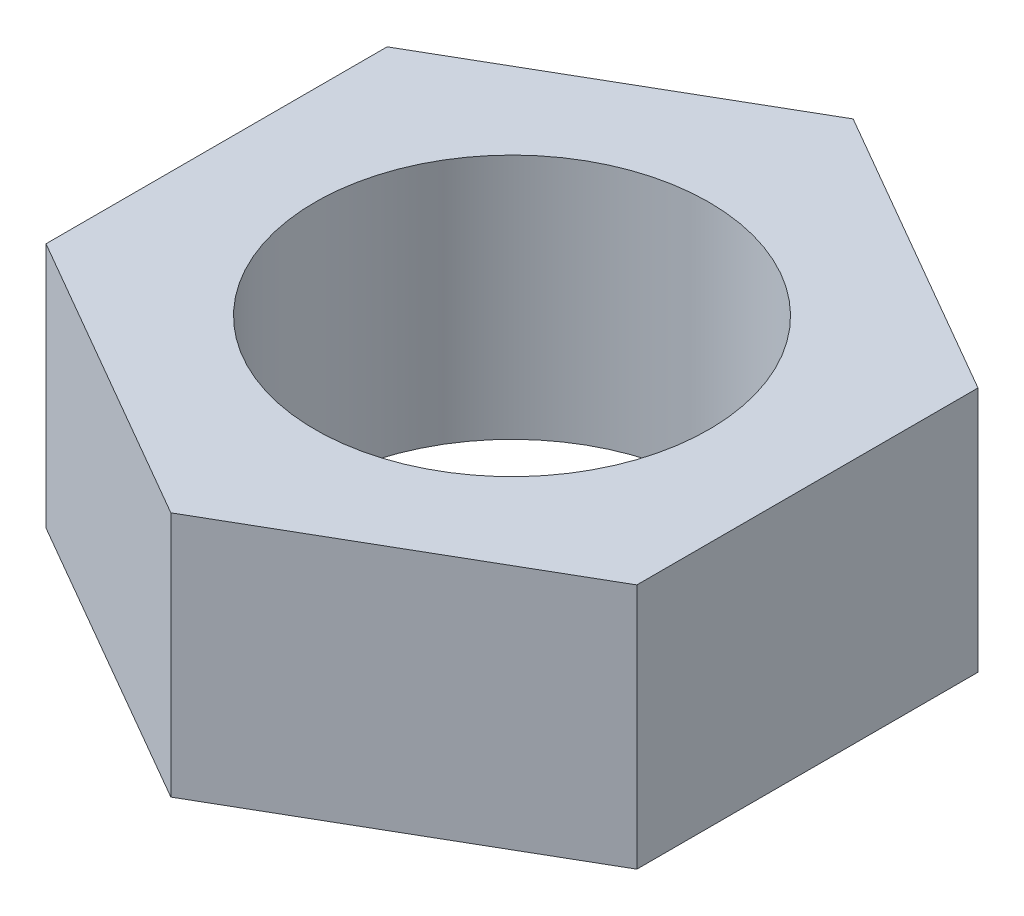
SolidWorks part; units mm, degrees
ref_plane "Front" through (0, 0, 0) normal (0, 0, 1) x (1, 0, 0)
ref_plane "Top" through (0, 0, 0) normal (0, 1, 0) x (1, 0, 0)
ref_plane "Right" through (0, 0, 0) normal (1, 0, 0) x (0, 0, -1)
sketch "Sketch3" plane through (0, 0, 0) normal (0, 1, 0) x (1, 0, 0)
  line L0 (0, -50) -> (0, 50) construction
  line L1 (0, 10.9985) -> (-9.525, 5.4993)
  line L2 (-9.525, 5.4993) -> (-9.525, -5.4993)
  line L3 (-9.525, -5.4993) -> (0, -10.9985)
  line L4 (0, -10.9985) -> (9.525, -5.4993)
  line L5 (9.525, -5.4993) -> (9.525, 5.4993)
  line L6 (9.525, 5.4993) -> (0, 10.9985)
  circle A0 centre (0, 0) radius 9.525 construction
  dimension "FLAT" = 19.05
extrude "Base-Extrude" add sketch "Sketch3" along normal blind 7.9375
sketch "Sketch4" plane through (0, 0, 0) normal (0, -1, 0) x (1, 0, 0)
  circle A0 centre (0, 0) radius 6.35
  dimension "SIZE" = 12.7
extrude "Cut-Extrude1" cut sketch "Sketch4" against normal through all
